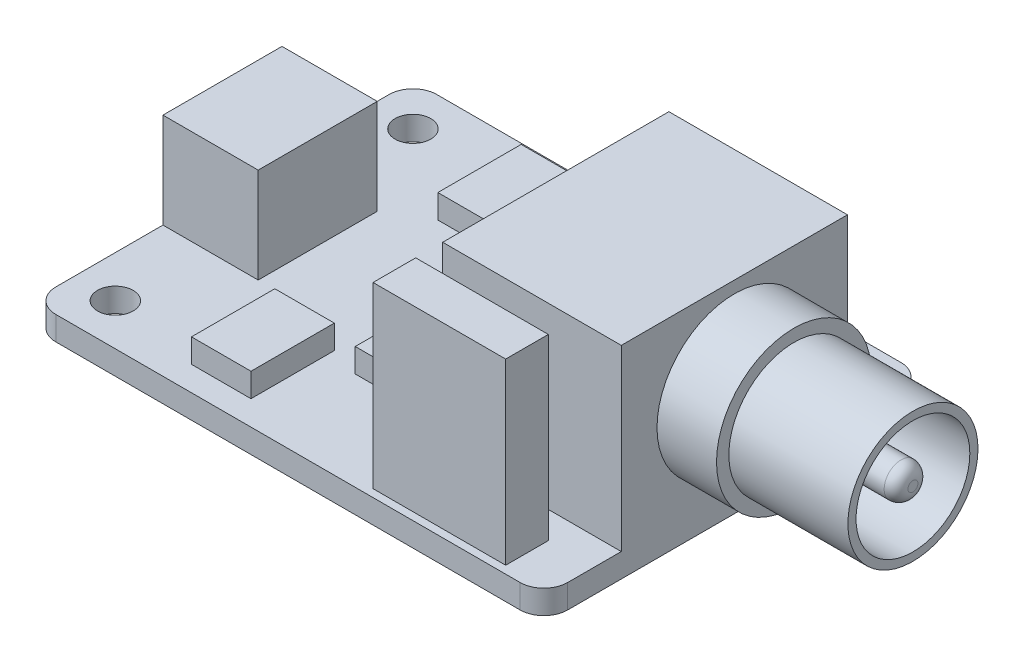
SolidWorks part; units mm, degrees
ref_plane "Front Plane" through (0, 0, 0) normal (0, 0, 1) x (1, 0, 0)
ref_plane "Top Plane" through (0, 0, 0) normal (0, 1, 0) x (1, 0, 0)
ref_plane "Right Plane" through (0, 0, 0) normal (1, 0, 0) x (0, 0, -1)
sketch "Sketch1" plane through (0, 0, 0) normal (0, 1, 0) x (1, 0, 0)
  line L1 (-179.1905, 78.9286) -> (-136.1905, 78.9286)
  line L2 (-179.1905, 78.9286) -> (-179.1905, 46.9286)
  line L3 (-179.1905, 46.9286) -> (-136.1905, 46.9286)
  line L4 (-136.1905, 78.9286) -> (-136.1905, 46.9286)
  circle A0 centre (-175.6905, 75.4286) radius 1.5
  circle A1 centre (-175.6905, 50.4286) radius 1.5
  dimension "D3" = 3
  dimension "D4" = 3
  dimension "D7" = 3.5
  dimension "D8" = 3.5
  dimension "D9" = 3.5
  dimension "D10" = 3.5
  dimension "D1" = 43
  dimension "D2" = 32
extrude "Boss-Extrude1" add sketch "Sketch1" along normal blind 2
fillet "Fillet1" radius 2 4 edges at (-179.1905, 1, -78.9286) (-136.1905, 1, -78.9286) (-136.1905, 1, -46.9286) (-179.1905, 1, -46.9286)
sketch "Sketch2" plane through (0, 2, 0) normal (0, 1, 0) x (1, 0, 0)
  line L0 (-179.1905, 76.9286) -> (-179.1905, 48.9286) construction
  line L1 (-195.986, 57.9286) -> (-187.986, 57.9286)
  line L2 (-195.986, 57.9286) -> (-195.986, 67.9286)
  line L3 (-195.986, 67.9286) -> (-187.986, 67.9286)
  line L4 (-187.986, 57.9286) -> (-187.986, 67.9286)
  line L6 (-151.1905, 53.4286) -> (-136.1905, 53.4286)
  line L7 (-151.1905, 53.4286) -> (-151.1905, 72.4286)
  line L8 (-151.1905, 72.4286) -> (-136.1905, 72.4286)
  line L9 (-136.1905, 53.4286) -> (-136.1905, 72.4286)
  line L10 (-136.1905, 48.9286) -> (-136.1905, 76.9286) construction
  line L11 (-177.1905, 46.9286) -> (-138.1905, 46.9286) construction
  line L12 (-138.1905, 78.9286) -> (-177.1905, 78.9286) construction
  line L14 (-151.1905, 51.1605) -> (-140.0499, 51.1605)
  line L15 (-151.1905, 51.1605) -> (-151.1905, 47.5777)
  line L16 (-151.1905, 47.5777) -> (-140.0499, 47.5777)
  line L17 (-140.0499, 51.1605) -> (-140.0499, 47.5777)
  point P4 (-195.986, 62.9286)
  point P7 (-179.1905, 62.9286)
  dimension "D1" = 10
  dimension "D2" = 8
  dimension "D4" = 15
  dimension "D5" = 6.5
  dimension "D6" = 6.5
extrude "Boss-Extrude2" add sketch "Sketch2" along normal blind 15 contours L8 L7 L6 M14 | L17 L14 L15 L16
sketch "Sketch3" plane through (0, 2, 0) normal (0, 1, 0) x (1, 0, 0)
  line L0 (-179.1905, 76.9286) -> (-179.1905, 48.9286) construction
  line L1 (-171.1905, 57.9286) -> (-179.1905, 57.9286)
  line L2 (-171.1905, 57.9286) -> (-171.1905, 67.9286)
  line L3 (-171.1905, 67.9286) -> (-179.1905, 67.9286)
  line L4 (-179.1905, 57.9286) -> (-179.1905, 67.9286)
  point P4 (-179.1905, 62.9286)
  point P7 (-179.1905, 62.9286)
  dimension "D1" = 8
  dimension "D2" = 10
extrude "Boss-Extrude3" add sketch "Sketch3" along normal blind 8
sketch "Sketch4" plane through (0, 2, 0) normal (0, 1, 0) x (1, 0, 0)
  line L1 (-155.2818, 71.9845) -> (-160.2818, 71.9845)
  line L2 (-155.2818, 71.9845) -> (-155.2818, 64.9845)
  line L3 (-155.2818, 64.9845) -> (-160.2818, 64.9845)
  line L4 (-160.2818, 71.9845) -> (-160.2818, 64.9845)
  line L5 (-155.2818, 62.1725) -> (-160.2818, 62.1725)
  line L6 (-155.2818, 62.1725) -> (-155.2818, 55.1725)
  line L7 (-155.2818, 55.1725) -> (-160.2818, 55.1725)
  line L8 (-160.2818, 62.1725) -> (-160.2818, 55.1725)
  line L9 (-163.0126, 76.8418) -> (-168.0126, 76.8418)
  line L10 (-163.0126, 76.8418) -> (-163.0126, 69.8418)
  line L11 (-163.0126, 69.8418) -> (-168.0126, 69.8418)
  line L12 (-168.0126, 76.8418) -> (-168.0126, 69.8418)
  line L13 (-162.8613, 55.9959) -> (-167.8613, 55.9959)
  line L14 (-162.8613, 55.9959) -> (-162.8613, 48.9959)
  line L15 (-162.8613, 48.9959) -> (-167.8613, 48.9959)
  line L16 (-167.8613, 55.9959) -> (-167.8613, 48.9959)
  dimension "D1" = 5
  dimension "D2" = 7
  dimension "D3" = 5
  dimension "D4" = 7
  dimension "D5" = 5
  dimension "D6" = 7
  dimension "D7" = 5
  dimension "D8" = 7
extrude "Boss-Extrude4" add sketch "Sketch4" along normal blind 2
sketch "Sketch5" plane through (-179.1905, 0, 0) normal (-1, 0, 0) x (0, 0, 1)
  line L0 (-67.9286, 10) -> (-57.9286, 10) construction
  line L1 (-66.9286, 9) -> (-58.9286, 9)
  line L2 (-66.9286, 9) -> (-66.9286, 3)
  line L3 (-66.9286, 3) -> (-58.9286, 3)
  line L4 (-58.9286, 9) -> (-58.9286, 3)
  line L5 (-57.9286, 10) -> (-57.9286, 2) construction
  line L6 (-67.9286, 2) -> (-76.9286, 2) construction
  line L7 (-67.9286, 10) -> (-67.9286, 2) construction
  line L9 (-65.7286, 6.5) -> (-64.7286, 6.5)
  line L10 (-65.7286, 6.5) -> (-65.7286, 5.5)
  line L11 (-65.7286, 5.5) -> (-64.7286, 5.5)
  line L12 (-64.7286, 6.5) -> (-64.7286, 5.5)
  line L13 (-63.4286, 6.5) -> (-62.4286, 6.5)
  line L14 (-63.4286, 6.5) -> (-63.4286, 5.5)
  line L15 (-63.4286, 5.5) -> (-62.4286, 5.5)
  line L16 (-62.4286, 6.5) -> (-62.4286, 5.5)
  line L17 (-61.1286, 6.5) -> (-60.1286, 6.5)
  line L18 (-61.1286, 6.5) -> (-61.1286, 5.5)
  line L19 (-61.1286, 5.5) -> (-60.1286, 5.5)
  line L20 (-60.1286, 6.5) -> (-60.1286, 5.5)
  point P24 (-65.2286, 6.5)
  dimension "D1" = 1
  dimension "D2" = 1
  dimension "D3" = 1
  dimension "D4" = 1
  dimension "D5" = 1
  dimension "D6" = 1
  dimension "D7" = 1
  dimension "D8" = 1
  dimension "D9" = 1
  dimension "D10" = 1
  dimension "D11" = 2.5
  dimension "D12" = 2.5
  dimension "D13" = 2.5
  dimension "D14" = 1.2
  dimension "D15" = 1.2
  dimension "D16" = 1.3
extrude "Cut-Extrude1" cut sketch "Sketch5" against normal blind 7
draft "Draft1" type of draft neutral plane draft angle 1 faces to draft 3 parameters "D1"=1
chamfer "Chamfer1" distance 2.5 angle 8 12 edges at (-179.2079, 5.5, -60.6286) (-179.1992, 6, -60.1286) (-179.1905, 6.5, -60.6286) (-179.1992, 6, -61.1286) (-179.2079, 5.5, -62.9286) (-179.1992, 6, -62.4286) (-179.1905, 6.5, -62.9286) (-179.1992, 6, -63.4286) (-179.1992, 6, -65.7286) (-179.2079, 5.5, -65.2286) (-179.1992, 6, -64.7286) (-179.1905, 6.5, -65.2286)
sketch "Sketch6" plane through (-136.1905, 0, 0) normal (1, 0, 0) x (0, 0, -1)
  line L0 (53.4286, 17) -> (72.4286, 17) construction
  circle A0 centre (62.9286, 9.5) radius 6.5
  point P6 (62.9286, 17)
  dimension "D1" = 13
  dimension "D2" = 7.5
extrude "Boss-Extrude5" add sketch "Sketch6" along normal blind 5
sketch "Sketch7" plane through (-131.1905, 0, 0) normal (1, 0, 0) x (0, 0, -1)
  circle A0 centre (62.9286, 9.5) radius 5.4647
  circle A1 centre (62.9286, 9.5) radius 6.5 construction
  dimension "D1" = 0
extrude "Boss-Extrude6" add sketch "Sketch7" along normal blind 10
sketch "Sketch8" plane through (-121.1905, 0, 0) normal (1, 0, 0) x (0, 0, -1)
  circle A0 centre (62.9286, 9.5) radius 4.7788
  circle A1 centre (62.9286, 9.5) radius 1.4184
extrude "Cut-Extrude2" cut sketch "Sketch8" against normal blind 15
fillet "Fillet3" radius 1 1 edges at (-121.1905, 9.5, -64.347)
